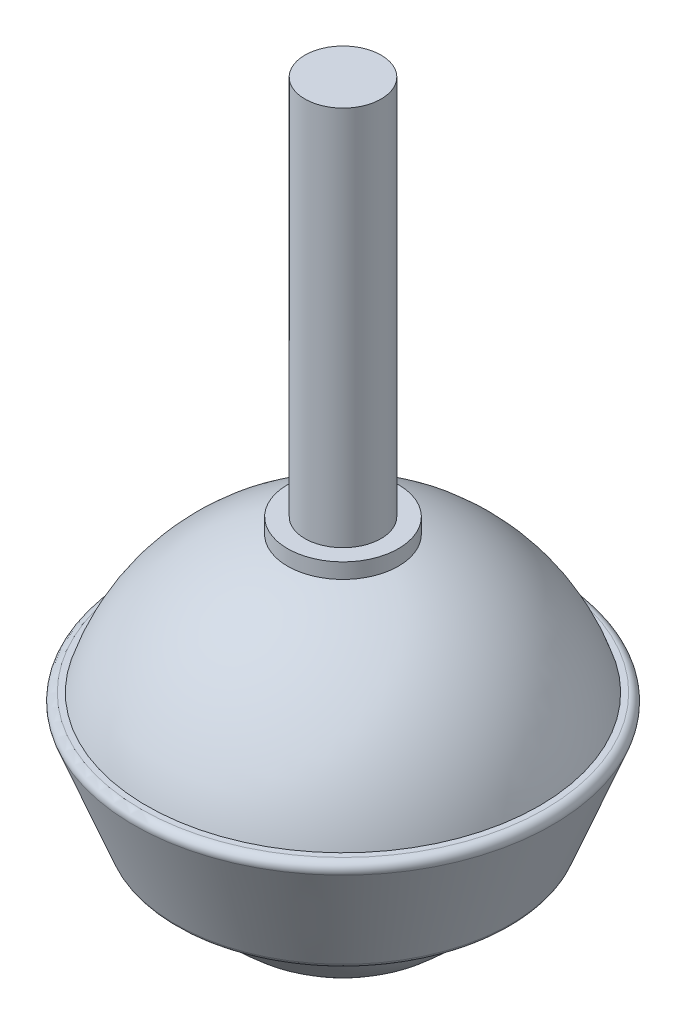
SolidWorks part; units mm, degrees
ref_plane "Plan de face" through (0, 0, 0) normal (0, 0, 1) x (1, 0, 0)
ref_plane "Plan de dessus" through (0, 0, 0) normal (0, 1, 0) x (1, 0, 0)
ref_plane "Plan de droite" through (0, 0, 0) normal (1, 0, 0) x (0, 0, -1)
sketch "Esquisse1" plane through (0, 0, 0) normal (0, 0, 1) x (1, 0, 0)
  line L0 (0, 0) -> (0, -98) construction
  line L1 (0, 0) -> (5, 0)
  line L2 (5, 0) -> (5, -50)
  line L3 (5, -50) -> (7.2801, -50)
  line L4 (7.2801, -50) -> (7.2801, -52)
  line L5 (25.7876, -70) -> (26.5358, -70)
  line L6 (27.4673, -71.3638) -> (21.9989, -85.3638)
  line L7 (21.0675, -86) -> (18.3303, -86)
  line L8 (0, 0) -> (0, -98)
  arc A0 (25.7876, -70) -> (7.2801, -52) centre (0, -78) ccw
  arc A1 (0, -98) -> (18.3303, -86) centre (0, -78) ccw
  arc A2 (27.4673, -71.3638) -> (26.5358, -70) centre (26.5358, -71) ccw
  arc A3 (21.0675, -86) -> (21.9989, -85.3638) centre (21.0675, -85) ccw
  point P14 (28, -70)
  dimension "D3" = 20
  dimension "D8" = 27
  dimension "D10" = 1
  dimension "D1" = 50
  dimension "D2" = 48
  dimension "D4" = 28
  dimension "D5" = 12
  dimension "D6" = 56
  dimension "D7" = 2
  dimension "D9" = 10
revolve "Révolution1" add sketch "Esquisse1" angle 360 about L0
